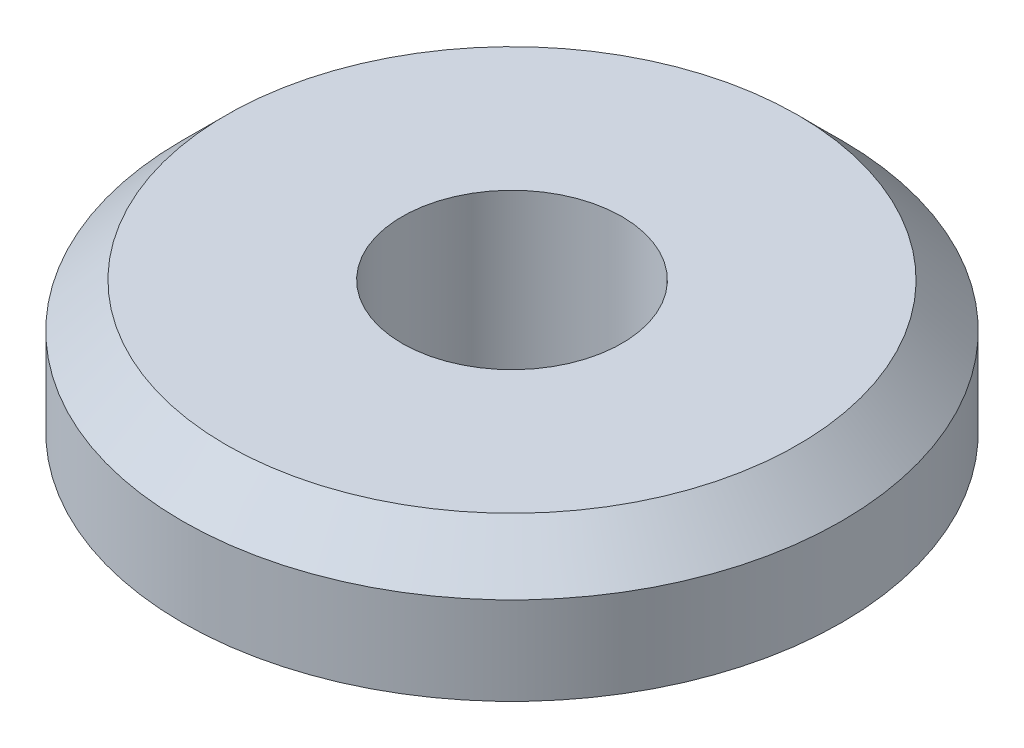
SolidWorks part; units mm, degrees
ref_plane "Front Plane" through (0, 0, 0) normal (0, 0, 1) x (1, 0, 0)
ref_plane "Top Plane" through (0, 0, 0) normal (0, 1, 0) x (1, 0, 0)
ref_plane "Right Plane" through (0, 0, 0) normal (1, 0, 0) x (0, 0, -1)
sketch "Sketch1" plane through (0, 0, 0) normal (0, 0, 1) x (1, 0, 0)
  line L0 (0, 13.2767) -> (0, 0) construction
  line L1 (0, 0) -> (13.4223, 0) construction
  line L2 (5, 0) -> (7.5, 0)
  line L3 (7.5, 0) -> (7.5, 5)
  line L4 (7.5, 5) -> (15, 5)
  line L5 (15, 5) -> (15, 9)
  line L6 (15, 9) -> (13, 11)
  line L7 (13, 11) -> (7, 11)
  line L10 (5, 9) -> (5, 0)
  line L11 (7, 11) -> (5, 11)
  line L12 (5, 11) -> (5, 9)
  dimension "D1" = 7.5
  dimension "D2" = 5
  dimension "D3" = 5
  dimension "D4" = 7.5
  dimension "D5" = 4
  dimension "D6" = 2
  dimension "D7" = 2
  dimension "D8" = 6
revolve "Revolve1" add sketch "Sketch1" angle 360 about L0
